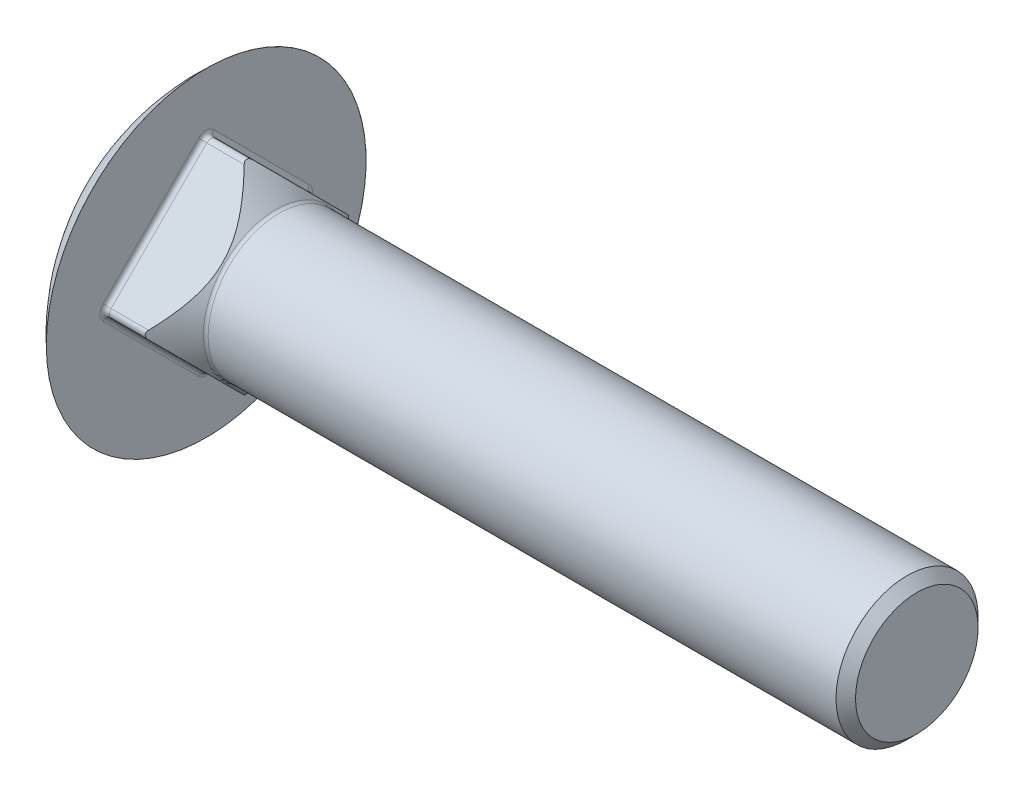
SolidWorks part; units mm, degrees
ref_plane "Front" through (0, 0, 0) normal (0, 0, 1) x (1, 0, 0)
ref_plane "Top" through (0, 0, 0) normal (0, 1, 0) x (1, 0, 0)
ref_plane "Right" through (0, 0, 0) normal (1, 0, 0) x (0, 0, -1)
sketch "Sketch1" plane through (0, 0, 0) normal (0, 0, 1) x (1, 0, 0)
  line L0 (-9.8282, 0) -> (16.3483, 0) construction
  line L1 (11.9999, 27) -> (12, 27)
  line L2 (0, 0) -> (12, 0)
  line L3 (12, 27) -> (12, 0)
  arc A0 (11.9999, 27) -> (0, 0) centre (36.3752, 0) ccw
  dimension "Head_dia" = 54
  dimension "Head_thickness" = 12
  dimension "H" = 0.0001
revolve "BaseHead" add sketch "Sketch1" angle 360 about L0
sketch "Sketch2" plane through (12, 0, 0) normal (1, 0, 0) x (0, 0, -1)
  line L1 (-17.5645, 0) -> (0, -17.5645)
  line L2 (0, -17.5645) -> (17.5645, 0)
  line L3 (17.5645, 0) -> (0, 17.5645)
  line L4 (0, 17.5645) -> (-17.5645, 0)
  circle A0 centre (0, 0) radius 12.42 construction
  dimension "square_neck" = 24.84
extrude "Neck" add sketch "Sketch2" along normal blind 12
sketch "Sketch3" plane through (0, 0, 0) normal (0, 0, 1) x (1, 0, 0)
  line L0 (5, 0) -> (14.6279, 0) construction
  line L1 (24, 17.5645) -> (18.4355, 17.5645)
  line L3 (18.4355, 17.5645) -> (24, 12)
  line L5 (24, 12) -> (24, 17.5645)
  dimension "D1" = 45
  dimension "D2" = 24
revolve "Cut-Revolve1" cut sketch "Sketch3" angle 360 about L0
fillet "RaCornNeck" radius 1 4 edges at (15.2177, 17.5645, 0) (15.2177, 0, 17.5645) (15.2177, -17.5645, 0) (15.2177, 0, -17.5645)
fillet "HeadFillet" radius 0.8 8 edges at (12, 8.7823, -8.7823) (12, -8.7823, -8.7823) (12, -8.7823, 8.7823) (12, 8.7823, 8.7823) (12, 17.1503, 0) (12, 0, -17.1503) (12, -17.1503, 0) (12, 0, 17.1503)
sketch "BodySke" plane through (0, 0, 0) normal (0, 1, 0) x (1, 0, 0)
  line L0 (-12.2854, 0) -> (141.5775, 0) construction
  line L1 (130.352, 12) -> (24, 12)
  line L2 (78, 18.4981) -> (78, -12.5734) construction
  line L4 (12, -27) -> (12, 27) construction
  line L5 (132, 10.352) -> (132, 0)
  line L6 (132, 0) -> (24, 0)
  line L7 (24, 0) -> (24, 12)
  line L8 (129, 21.1398) -> (129, -17.9826) construction
  line L9 (130.352, 12) -> (132, 10.352)
  line L10 (24, -12) -> (24, 12) construction
  dimension "Diameter" = 24
  dimension "Length" = 120
  dimension "Ang" = 45
  dimension "Minor_dia" = 20.704
  dimension "Advance" = 3
  dimension "Thread_length" = 54
revolve "BaseBody" add sketch "BodySke" angle 360 about L0
fillet "NeckFillet" radius 0.8 1 edges at (24, 0, 12)
sketch "ThdSchSke" plane through (0, 0, 0) normal (0, 0, 1) x (1, 0, 0)
  line L0 (128.0485, 13.9029) -> (129.9515, 13.9029)
  line L1 (129.9515, 13.9029) -> (129.9515, 12)
  line L2 (129.9515, 12) -> (129, 10.352)
  line L3 (128.0485, 12) -> (129, 10.352)
  line L4 (128.0485, 13.9029) -> (128.0485, 12)
  line L5 (-65.6461, 0) -> (65.6461, 0) construction
  line L6 (128.0485, 12) -> (129.9515, 12) construction
  line L7 (129, 12) -> (129, 10.352) construction
  line L10 (132, -10.352) -> (132, 10.352) construction
  dimension "D1" = 20.704
  dimension "D3" = 3
  dimension "D4" = 24
revolve "ThreadSchematic" [suppressed] cut sketch "ThdSchSke" angle 360 about L5
pattern_linear "ThdSchPat" [suppressed] count 17 spacing 3 along (1, 0, 0)
equation "\"D3@ThdSchPat\" =\"Advance@BodySke\""
equation "\"D1@ThdSchPat\" =  int( \"Thread_length@BodySke\"/\"Advance@BodySke\") -1"
equation "\"D1@NeckFillet\"=\"r_headandneck@HeadFillet\""
equation "\"D1@ThdSchSke\"=\"Minor_dia@BodySke\""
equation "\"D4@ThdSchSke\"=\"Diameter@BodySke\""
equation "\"D3@ThdSchSke\"=\"Advance@BodySke\""
equation "\"D2@Sketch3\"=\"Diameter@BodySke\""
equation "\"D1@ThreadCosmetic\"=\"Thread_length@BodySke\""
equation "\"dn@ThreadCosmetic\" = \"Minor_dia@BodySke\""
